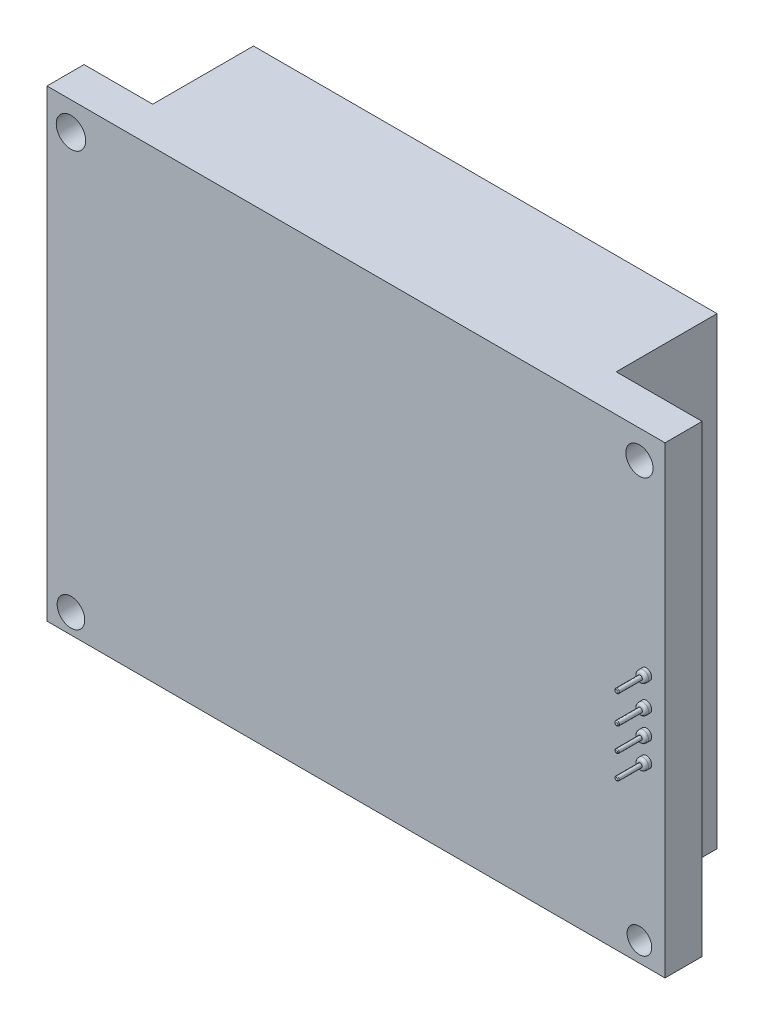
SolidWorks part; units mm, degrees
ref_plane "Plan de face" through (0, 0, 0) normal (0, 0, 1) x (1, 0, 0)
ref_plane "Plan de dessus" through (0, 0, 0) normal (0, 1, 0) x (1, 0, 0)
ref_plane "Plan de droite" through (0, 0, 0) normal (1, 0, 0) x (0, 0, -1)
sketch "Esquisse1" plane through (0, 0, 0) normal (0, 0, 1) x (1, 0, 0)
  line L1 (0, 0) -> (4000, 0)
  line L2 (0, 0) -> (0, 3000)
  line L3 (0, 3000) -> (4000, 3000)
  line L4 (4000, 0) -> (4000, 3000)
  dimension "D1" = 3000
  dimension "D2" = 4000
extrude "Boss.-Extru.1" add sketch "Esquisse1" along normal blind 239.9402
sketch "Esquisse2" plane through (0, 0, 0) normal (0, 0, -1) x (-1, 0, 0)
  line L0 (0, 0) -> (-4000, 0) construction
  line L1 (-3444.2239, 0) -> (-444.2239, 0)
  line L2 (-3444.2239, 0) -> (-3444.2239, 3000)
  line L3 (-3444.2239, 3000) -> (-444.2239, 3000)
  line L4 (-444.2239, 0) -> (-444.2239, 3000)
  line L5 (-4000, 3000) -> (0, 3000) construction
  dimension "D1" = 3000
extrude "Boss.-Extru.2" add sketch "Esquisse2" along normal blind 652.3769
sketch "Esquisse11" plane through (0, 0, 0) normal (0, 0, -1) x (-1, 0, 0)
  circle A0 centre (-3834.3197, 2817.8665) radius 88.1316
  circle A1 centre (-3834.3197, 128.1231) radius 79.8809
  circle A2 centre (-155.0778, 128.1231) radius 89.2717
  circle A3 centre (-155.0778, 2817.8665) radius 95.2203
extrude "Enlèv. mat.-Extru.1" cut sketch "Esquisse11" against normal blind 652.3769
sketch "Esquisse13" plane through (0, 0, 0) normal (0, 0, -1) x (-1, 0, 0)
  circle A0 centre (-3879.0201, 1151.856) radius 35
  circle A1 centre (-3879.0201, 1305.8293) radius 35
  circle A2 centre (-3879.0201, 1459.8027) radius 35
  circle A3 centre (-3879.0201, 1640.7044) radius 35
  dimension "D1" = 70
  dimension "D2" = 70
  dimension "D3" = 70
  dimension "D4" = 70
extrude "Boss.-Extru.3" add sketch "Esquisse13" along normal blind 40.3769 contours A3 | A2 | A1 | A0
sketch "Esquisse16" plane through (0, 0, 239.9402) normal (0, 0, 1) x (1, 0, 0)
  circle A0 centre (3879.0201, 1151.856) radius 35
  circle A1 centre (3879.0201, 1642.9589) radius 35
  circle A2 centre (3879.0201, 1461.3611) radius 35
  circle A3 centre (3879.0201, 1305.9312) radius 35
  dimension "D1" = 70
  dimension "D2" = 70
  dimension "D3" = 70
  dimension "D4" = 70
extrude "Boss.-Extru.4" add sketch "Esquisse16" along normal blind 40.3769
sketch "Esquisse17" plane through (0, 0, 280.3171) normal (0, 0, 1) x (1, 0, 0)
  circle A0 centre (3879.0201, 1461.3611) radius 14.5715
  circle A1 centre (3879.0201, 1305.9935) radius 12.9077
  circle A2 centre (3879.0201, 1151.856) radius 13.2758
  circle A3 centre (3879.0201, 1642.9589) radius 14.254
extrude "Boss.-Extru.5" add sketch "Esquisse17" along normal blind 153.0403
fillet "Congé1" radius 20 1 edges at (3914.0201, 1151.856, 280.3171)
fillet "Congé2" radius 20 2 edges at (3914.0201, 1461.3611, 280.3171) (3914.0201, 1305.9312, 280.3171)
fillet "Congé3" radius 20 1 edges at (3914.0201, 1642.9589, 280.3171)
fillet "Congé4" radius 5 1 edges at (3893.5916, 1461.3611, 433.3574)
fillet "Congé5" radius 5 3 edges at (3893.2741, 1642.9589, 433.3574) (3892.2959, 1151.856, 433.3574) (3891.9278, 1305.9935, 433.3574)
scale "Echelle1" scale about centroid uniform scaling yes scale factor 0.01
sketch "Esquisse19" plane through (0, 0, -184.8522) normal (0, 0, -1) x (-1, 0, 0)
  line L0 (-1948.1023, 1484.7674) -> (-1948.1023, 1514.7674) construction
  line L1 (-1978.1023, 1484.7674) -> (-1948.1023, 1484.7674)
  line L2 (-1978.1023, 1484.7674) -> (-1978.1023, 1488.5174)
  line L3 (-1978.1023, 1488.5174) -> (-1948.1023, 1488.5174)
  line L4 (-1948.1023, 1484.7674) -> (-1948.1023, 1488.5174)
  line L6 (-1978.1023, 1488.5174) -> (-1948.1023, 1488.5174)
  line L7 (-1978.1023, 1488.5174) -> (-1978.1023, 1492.2674)
  line L8 (-1978.1023, 1492.2674) -> (-1948.1023, 1492.2674)
  line L9 (-1948.1023, 1488.5174) -> (-1948.1023, 1492.2674)
  line L10 (-1978.1023, 1492.2674) -> (-1948.1023, 1492.2674)
  line L11 (-1978.1023, 1492.2674) -> (-1978.1023, 1496.0174)
  line L12 (-1978.1023, 1496.0174) -> (-1948.1023, 1496.0174)
  line L13 (-1948.1023, 1492.2674) -> (-1948.1023, 1496.0174)
  line L14 (-1978.1023, 1496.0174) -> (-1948.1023, 1496.0174)
  line L15 (-1978.1023, 1496.0174) -> (-1978.1023, 1499.7674)
  line L16 (-1978.1023, 1499.7674) -> (-1948.1023, 1499.7674)
  line L17 (-1948.1023, 1496.0174) -> (-1948.1023, 1499.7674)
  line L18 (-1978.1023, 1499.7674) -> (-1948.1023, 1499.7674)
  line L19 (-1978.1023, 1499.7674) -> (-1978.1023, 1503.5174)
  line L20 (-1978.1023, 1503.5174) -> (-1948.1023, 1503.5174)
  line L21 (-1948.1023, 1499.7674) -> (-1948.1023, 1503.5174)
  line L22 (-1978.1023, 1503.5174) -> (-1948.1023, 1503.5174)
  line L23 (-1978.1023, 1503.5174) -> (-1978.1023, 1507.2674)
  line L24 (-1978.1023, 1507.2674) -> (-1948.1023, 1507.2674)
  line L25 (-1948.1023, 1503.5174) -> (-1948.1023, 1507.2674)
  line L26 (-1978.1023, 1507.2674) -> (-1948.1023, 1507.2674)
  line L27 (-1978.1023, 1507.2674) -> (-1978.1023, 1511.0174)
  line L28 (-1978.1023, 1511.0174) -> (-1948.1023, 1511.0174)
  line L29 (-1948.1023, 1507.2674) -> (-1948.1023, 1511.0174)
  line L30 (-1978.1023, 1511.0174) -> (-1948.1023, 1511.0174)
  line L31 (-1978.1023, 1511.0174) -> (-1978.1023, 1514.7674)
  line L32 (-1978.1023, 1514.7674) -> (-1948.1023, 1514.7674)
  line L33 (-1948.1023, 1511.0174) -> (-1948.1023, 1514.7674)
  dimension "D1" = 3.75
  dimension "D2" = 3.75
  dimension "D3" = 3.75
  dimension "D4" = 3.75
  dimension "D5" = 3.75
  dimension "D6" = 3.75
  dimension "D7" = 3.75
sketch "Esquisse20" plane through (0, 0, -184.8522) normal (0, 0, -1) x (-1, 0, 0)
  line L1 (-1948.1023, 1484.7674) -> (-1951.8523, 1484.7674)
  line L2 (-1948.1023, 1484.7674) -> (-1948.1023, 1514.6366)
  line L3 (-1948.1023, 1514.6366) -> (-1951.8523, 1514.6366)
  line L4 (-1951.8523, 1484.7674) -> (-1951.8523, 1514.6366)
  line L5 (-1951.8523, 1484.7674) -> (-1955.6023, 1484.7674)
  line L6 (-1951.8523, 1484.7674) -> (-1951.8523, 1514.6366)
  line L7 (-1951.8523, 1514.6366) -> (-1955.6023, 1514.6366)
  line L8 (-1955.6023, 1484.7674) -> (-1955.6023, 1514.6366)
  line L9 (-1955.6023, 1484.7674) -> (-1959.3523, 1484.7674)
  line L10 (-1955.6023, 1484.7674) -> (-1955.6023, 1514.6366)
  line L11 (-1955.6023, 1514.6366) -> (-1959.3523, 1514.6366)
  line L12 (-1959.3523, 1484.7674) -> (-1959.3523, 1514.6366)
  line L13 (-1959.3523, 1484.7674) -> (-1963.1023, 1484.7674)
  line L14 (-1959.3523, 1484.7674) -> (-1959.3523, 1514.6366)
  line L15 (-1959.3523, 1514.6366) -> (-1963.1023, 1514.6366)
  line L16 (-1963.1023, 1484.7674) -> (-1963.1023, 1514.6366)
  line L17 (-1963.1023, 1484.7674) -> (-1966.8523, 1484.7674)
  line L18 (-1963.1023, 1484.7674) -> (-1963.1023, 1514.6366)
  line L19 (-1963.1023, 1514.6366) -> (-1966.8523, 1514.6366)
  line L20 (-1966.8523, 1484.7674) -> (-1966.8523, 1514.6366)
  line L21 (-1966.8523, 1484.7674) -> (-1970.6023, 1484.7674)
  line L22 (-1966.8523, 1484.7674) -> (-1966.8523, 1514.6366)
  line L23 (-1966.8523, 1514.6366) -> (-1970.6023, 1514.6366)
  line L24 (-1970.6023, 1484.7674) -> (-1970.6023, 1514.6366)
  line L25 (-1970.6023, 1484.7674) -> (-1974.3523, 1484.7674)
  line L26 (-1970.6023, 1484.7674) -> (-1970.6023, 1514.6366)
  line L27 (-1970.6023, 1514.6366) -> (-1974.3523, 1514.6366)
  line L28 (-1974.3523, 1484.7674) -> (-1974.3523, 1514.6366)
  line L29 (-1974.3523, 1484.7674) -> (-1978.1023, 1484.7674)
  line L30 (-1974.3523, 1484.7674) -> (-1974.3523, 1514.7674)
  line L31 (-1974.3523, 1514.7674) -> (-1978.1023, 1514.7674)
  line L32 (-1978.1023, 1484.7674) -> (-1978.1023, 1514.7674)
  dimension "D1" = 3.75
  dimension "D2" = 3.75
  dimension "D3" = 3.75
  dimension "D4" = 3.75
  dimension "D5" = 3.75
  dimension "D6" = 3.75
  dimension "D7" = 3.75
  dimension "D8" = 3.75
